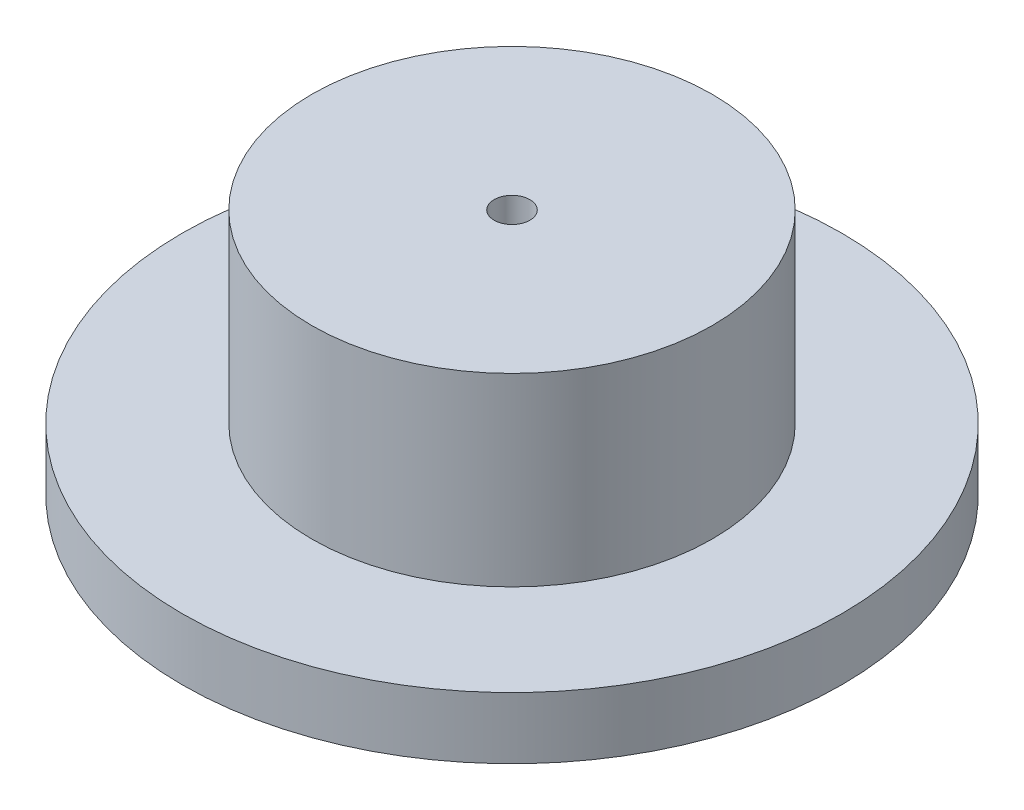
SolidWorks part; units mm, degrees
ref_plane "Front" through (0, 0, 0) normal (0, 0, 1) x (1, 0, 0)
ref_plane "Top" through (0, 0, 0) normal (0, 1, 0) x (1, 0, 0)
ref_plane "Right" through (0, 0, 0) normal (1, 0, 0) x (0, 0, -1)
sketch "Sketch1" plane through (0, 0, 0) normal (0, 1, 0) x (1, 0, 0)
  circle A0 centre (0, 0) radius 12.25 construction
  circle A1 centre (0, 0) radius 16.25 construction
  circle A2 centre (0, 0) radius 26.75
  circle A8 centre (0, 0) radius 38.75
  circle A9 centre (0, 0) radius 1.5
  dimension "D1" = 24.5
  dimension "D2" = 32.5
  dimension "D3" = 53.5
  dimension "D4" = 3
  dimension "D8" = 77.5
extrude "Boss-Extrude1" add sketch "Sketch1" along normal blind 5 contours A2 A9
sketch "Sketch3" plane through (0, 5, 0) normal (0, 1, 0) x (1, 0, 0)
  circle A0 centre (0, 0) radius 16.25
  circle A1 centre (0, 0) radius 1.4515
  dimension "D1" = 32.5
  dimension "D2" = 2.903
extrude "Boss-Extrude3" add sketch "Sketch3" along normal blind 15
ref_point "Point1"
